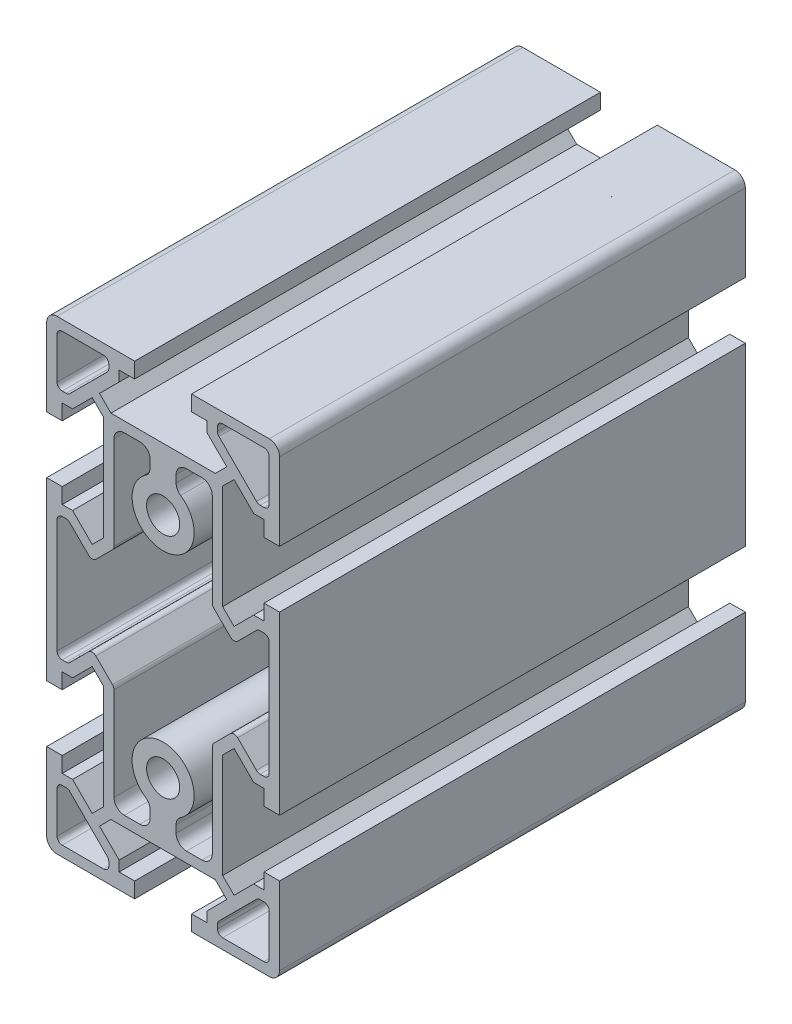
SolidWorks part; units mm, degrees
ref_plane "Face" through (0, 0, 0) normal (0, 0, 1) x (1, 0, 0)
ref_plane "Dessus" through (0, 0, 0) normal (0, 1, 0) x (1, 0, 0)
ref_plane "Droite" through (0, 0, 0) normal (1, 0, 0) x (0, 0, -1)
sketch "Esquisse1" plane through (0, 0, 0) normal (0, 0, 1) x (1, 0, 0)
  line L0 (-112.9997, 0) -> (109.1853, 0) construction
  line L1 (0, -66.2741) -> (0, 93.4512) construction
  line L2 (-5.5, 45) -> (-5.5, 42)
  line L3 (-22.5, 45) -> (-5.5, 45)
  line L4 (-22.5, 45) -> (-22.5, 28)
  line L5 (-13.7071, 10.2071) -> (-11.5, 12.4142)
  line L6 (-17.5, 14) -> (-13.7071, 10.2071)
  line L7 (-5.5, 42) -> (-8.5, 42)
  line L8 (-8.5, 42) -> (-8.5, 40)
  line L9 (-8.5, 40) -> (-12.2929, 36.2071)
  line L10 (-18.3284, 33) -> (-10.5, 40.8284)
  line L11 (-10.0858, 34) -> (10.0858, 34)
  line L12 (-34.5899, 22.5) -> (23.1177, 22.5) construction
  line L13 (-22.5, 28) -> (-19.5, 28)
  line L14 (-19.5, 28) -> (-19.5, 31)
  line L15 (-19.5, 31) -> (-17.5, 31)
  line L16 (-17.5, 31) -> (-13.7071, 34.7929)
  line L17 (-20.5, 33) -> (-18.3284, 33)
  line L18 (-11.5, 32.5858) -> (-11.5, 22.5)
  line L19 (-19.5, 14) -> (-17.5, 14)
  line L20 (-9.5, 32) -> (-9.5, 22.5)
  line L21 (-9.5, 32) -> (-2.5, 32)
  line L22 (-2.5, 32) -> (-2.5, 27.4544)
  line L23 (-20.5, 43) -> (-20.5, 33)
  line L24 (-20.5, 43) -> (-10.5, 43)
  line L25 (-10.5, 43) -> (-10.5, 40.8284)
  line L26 (-19.5, 17) -> (-19.5, 14)
  line L27 (-13.7071, 34.7929) -> (-11.5, 32.5858)
  line L28 (-12.2929, 36.2071) -> (-10.0858, 34)
  line L29 (-22.5, 17) -> (-19.5, 17)
  line L30 (-22.5, 17) -> (-22.5, -17)
  line L31 (-9.5, 22.5) -> (-9.5, 11.5858)
  line L32 (-13.7071, 7.3787) -> (-9.5, 11.5858)
  line L33 (-18.3284, 12) -> (-13.7071, 7.3787)
  line L34 (-20.5, 12) -> (-18.3284, 12)
  line L35 (-20.5, 12) -> (-20.5, -12)
  line L36 (-11.5, 22.5) -> (-11.5, 12.4142)
  line L37 (11.5, 22.5) -> (11.5, 12.4142)
  line L38 (20.5, 12) -> (20.5, -12)
  line L39 (20.5, 12) -> (18.3284, 12)
  line L40 (18.3284, 12) -> (13.7071, 7.3787)
  line L41 (13.7071, 7.3787) -> (9.5, 11.5858)
  line L42 (9.5, 22.5) -> (9.5, 11.5858)
  line L43 (22.5, 17) -> (22.5, -17)
  line L44 (22.5, 17) -> (19.5, 17)
  line L45 (12.2929, 36.2071) -> (10.0858, 34)
  line L46 (13.7071, 34.7929) -> (11.5, 32.5858)
  line L47 (19.5, 17) -> (19.5, 14)
  line L48 (10.5, 43) -> (10.5, 40.8284)
  line L49 (20.5, 43) -> (10.5, 43)
  line L50 (20.5, 43) -> (20.5, 33)
  line L51 (2.5, 32) -> (2.5, 27.4544)
  line L52 (9.5, 32) -> (2.5, 32)
  line L53 (9.5, 32) -> (9.5, 22.5)
  line L54 (19.5, 14) -> (17.5, 14)
  line L55 (11.5, 32.5858) -> (11.5, 22.5)
  line L56 (20.5, 33) -> (18.3284, 33)
  line L57 (17.5, 31) -> (13.7071, 34.7929)
  line L58 (19.5, 31) -> (17.5, 31)
  line L59 (19.5, 28) -> (19.5, 31)
  line L60 (22.5, 28) -> (19.5, 28)
  line L61 (18.3284, 33) -> (10.5, 40.8284)
  line L62 (8.5, 40) -> (12.2929, 36.2071)
  line L63 (8.5, 42) -> (8.5, 40)
  line L64 (5.5, 42) -> (8.5, 42)
  line L65 (17.5, 14) -> (13.7071, 10.2071)
  line L66 (13.7071, 10.2071) -> (11.5, 12.4142)
  line L67 (22.5, 45) -> (22.5, 28)
  line L68 (22.5, 45) -> (5.5, 45)
  line L69 (5.5, 45) -> (5.5, 42)
  line L70 (5.5, -45) -> (5.5, -42)
  line L71 (22.5, -45) -> (5.5, -45)
  line L72 (22.5, -45) -> (22.5, -28)
  line L73 (13.7071, -10.2071) -> (11.5, -12.4142)
  line L74 (17.5, -14) -> (13.7071, -10.2071)
  line L75 (5.5, -42) -> (8.5, -42)
  line L76 (8.5, -42) -> (8.5, -40)
  line L77 (8.5, -40) -> (12.2929, -36.2071)
  line L78 (18.3284, -33) -> (10.5, -40.8284)
  line L79 (22.5, -28) -> (19.5, -28)
  line L80 (19.5, -28) -> (19.5, -31)
  line L81 (19.5, -31) -> (17.5, -31)
  line L82 (17.5, -31) -> (13.7071, -34.7929)
  line L83 (20.5, -33) -> (18.3284, -33)
  line L84 (11.5, -32.5858) -> (11.5, -22.5)
  line L85 (19.5, -14) -> (17.5, -14)
  line L86 (9.5, -32) -> (9.5, -22.5)
  line L87 (9.5, -32) -> (2.5, -32)
  line L88 (2.5, -32) -> (2.5, -27.4544)
  line L89 (20.5, -43) -> (20.5, -33)
  line L90 (20.5, -43) -> (10.5, -43)
  line L91 (10.5, -43) -> (10.5, -40.8284)
  line L92 (19.5, -17) -> (19.5, -14)
  line L93 (13.7071, -34.7929) -> (11.5, -32.5858)
  line L94 (12.2929, -36.2071) -> (10.0858, -34)
  line L95 (22.5, -17) -> (19.5, -17)
  line L96 (9.5, -22.5) -> (9.5, -11.5858)
  line L97 (13.7071, -7.3787) -> (9.5, -11.5858)
  line L98 (18.3284, -12) -> (13.7071, -7.3787)
  line L99 (20.5, -12) -> (18.3284, -12)
  line L100 (11.5, -22.5) -> (11.5, -12.4142)
  line L101 (-11.5, -22.5) -> (-11.5, -12.4142)
  line L102 (-20.5, -12) -> (-18.3284, -12)
  line L103 (-18.3284, -12) -> (-13.7071, -7.3787)
  line L104 (-13.7071, -7.3787) -> (-9.5, -11.5858)
  line L105 (-9.5, -22.5) -> (-9.5, -11.5858)
  line L106 (-22.5, -17) -> (-19.5, -17)
  line L107 (-12.2929, -36.2071) -> (-10.0858, -34)
  line L108 (-13.7071, -34.7929) -> (-11.5, -32.5858)
  line L109 (-19.5, -17) -> (-19.5, -14)
  line L110 (-10.5, -43) -> (-10.5, -40.8284)
  line L111 (-20.5, -43) -> (-10.5, -43)
  line L112 (-20.5, -43) -> (-20.5, -33)
  line L113 (-2.5, -32) -> (-2.5, -27.4544)
  line L114 (-9.5, -32) -> (-2.5, -32)
  line L115 (-9.5, -32) -> (-9.5, -22.5)
  line L116 (-19.5, -14) -> (-17.5, -14)
  line L117 (-11.5, -32.5858) -> (-11.5, -22.5)
  line L118 (-20.5, -33) -> (-18.3284, -33)
  line L119 (-17.5, -31) -> (-13.7071, -34.7929)
  line L120 (-19.5, -31) -> (-17.5, -31)
  line L121 (-19.5, -28) -> (-19.5, -31)
  line L122 (-22.5, -28) -> (-19.5, -28)
  line L123 (-10.0858, -34) -> (10.0858, -34)
  line L124 (-18.3284, -33) -> (-10.5, -40.8284)
  line L125 (-8.5, -40) -> (-12.2929, -36.2071)
  line L126 (-8.5, -42) -> (-8.5, -40)
  line L127 (-5.5, -42) -> (-8.5, -42)
  line L128 (-17.5, -14) -> (-13.7071, -10.2071)
  line L129 (-13.7071, -10.2071) -> (-11.5, -12.4142)
  line L130 (-22.5, -45) -> (-22.5, -28)
  line L131 (-22.5, -45) -> (-5.5, -45)
  line L132 (-5.5, -45) -> (-5.5, -42)
  arc A0 (-2.5, 27.4544) -> (2.5, 27.4544) centre (0, 22) ccw
  arc A1 (-2.5, -27.4544) -> (2.5, -27.4544) centre (0, -22) cw
  point P7 (-11.5, 22.5)
  point P74 (0, 34)
  point P111 (22.5, 0)
  point P115 (20.5, 0)
  point P118 (-20.5, 0)
  point P123 (-22.5, 0)
  point P147 (0, -34)
  dimension "D19" = 6
  dimension "D1" = 3
  dimension "D3" = 45
  dimension "D4" = 22.5
  dimension "D5" = 11
  dimension "D6" = 2
  dimension "D7" = 2
  dimension "D8" = 2
  dimension "D9" = 8.5
  dimension "D10" = 5.5
  dimension "D11" = 22.5
  dimension "D12" = 3
  dimension "D13" = 2
  dimension "D14" = 8.5
  dimension "D15" = 45
  dimension "D16" = 11
  dimension "D17" = 5.5
  dimension "D18" = 22
  dimension "D20" = 5
  dimension "D21" = 2
  dimension "D22" = 2
extrude "Extrusion1" add sketch "Esquisse1" along normal blind 90
fillet "Congé1" radius 2
fillet "Congé2" radius 2
fillet "Congé3" radius 1
fillet "Congé4" radius 1
hole_wizard "Trou taraudé M8x1.251" positions "Esquisse3" profile "Esquisse2" tap size "M8x1.25" standard "ISO"
sketch "Esquisse3" plane through (0, 0, 90) normal (0, 0, 1) x (1, 0, 0)
  arc A0 (-3.375, 26.9608) -> (3.375, 26.9608) centre (0, 22) ccw construction
  arc A1 (3.375, -26.9608) -> (-3.375, -26.9608) centre (0, -22) ccw construction
  point P0 (0, 22)
  point P1 (0, -22)
sketch "Esquisse2" plane through (0, 22, 90) normal (1, 0, 0) x (0, -1, 0)
  line L0 (0, 0) -> (0, 90)
  line L1 (0, 90) -> (3.2, 90)
  line L2 (3.2, 90) -> (3.2, 0)
  line L5 (3.2, 0) -> (0, 0)
  line L11 (0, -6.35) -> (0, 107.95) construction
  dimension "Diamètre du trou pour taraudage jusqu'au prochain" = 6.4
  dimension "Profondeur du trou pour taraudage jusqu'au prochain" = 90
